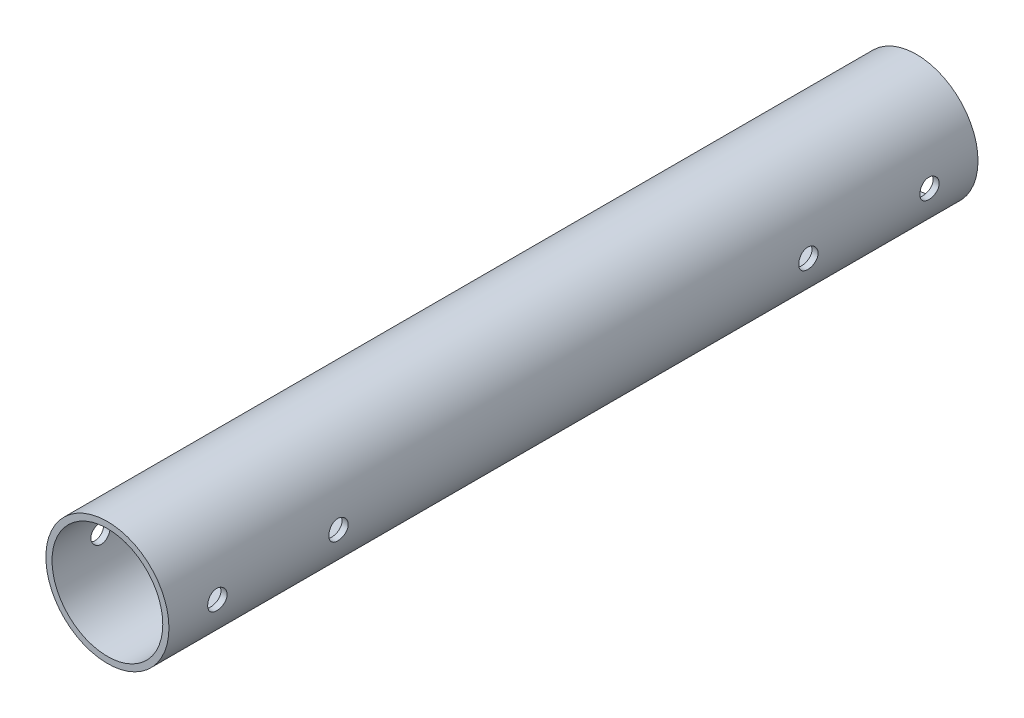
SolidWorks part; units mm, degrees
ref_plane "Front Plane" through (0, 0, 0) normal (1, 0, 0) x (0, 1, 0)
ref_plane "Top Plane" through (0, 0, 0) normal (0, 0, 1) x (0, 1, 0)
ref_plane "Right Plane" through (0, 0, 0) normal (0, 1, 0) x (-1, 0, 0)
sketch "Sketch1" plane through (0, 0, 0) normal (0, 0, 1) x (0, 1, 0)
  circle A0 centre (0, 0) radius 12.7
  circle A1 centre (0, 0) radius 11.43
  dimension "D1" = 25.4
  dimension "D2" = 1.27
extrude "Boss-Extrude1" add sketch "Sketch1" along normal blind 167
sketch "Sketch2" plane through (0, 0, 0) normal (1, 0, 0) x (0, 1, 0)
  line L1 (12.7, 167) -> (-12.7, 167) construction
  circle A0 centre (0, 10) radius 2
  circle A1 centre (0, 35) radius 2
  circle A2 centre (0, 157) radius 2
  circle A3 centre (0, 132) radius 2
  dimension "D1" = 4
  dimension "D2" = 10
  dimension "D3" = 25
  dimension "D4" = 25
  dimension "D5" = 10
extrude "Cut-Extrude2" cut sketch "Sketch2" against normal through all both and the other way through all
